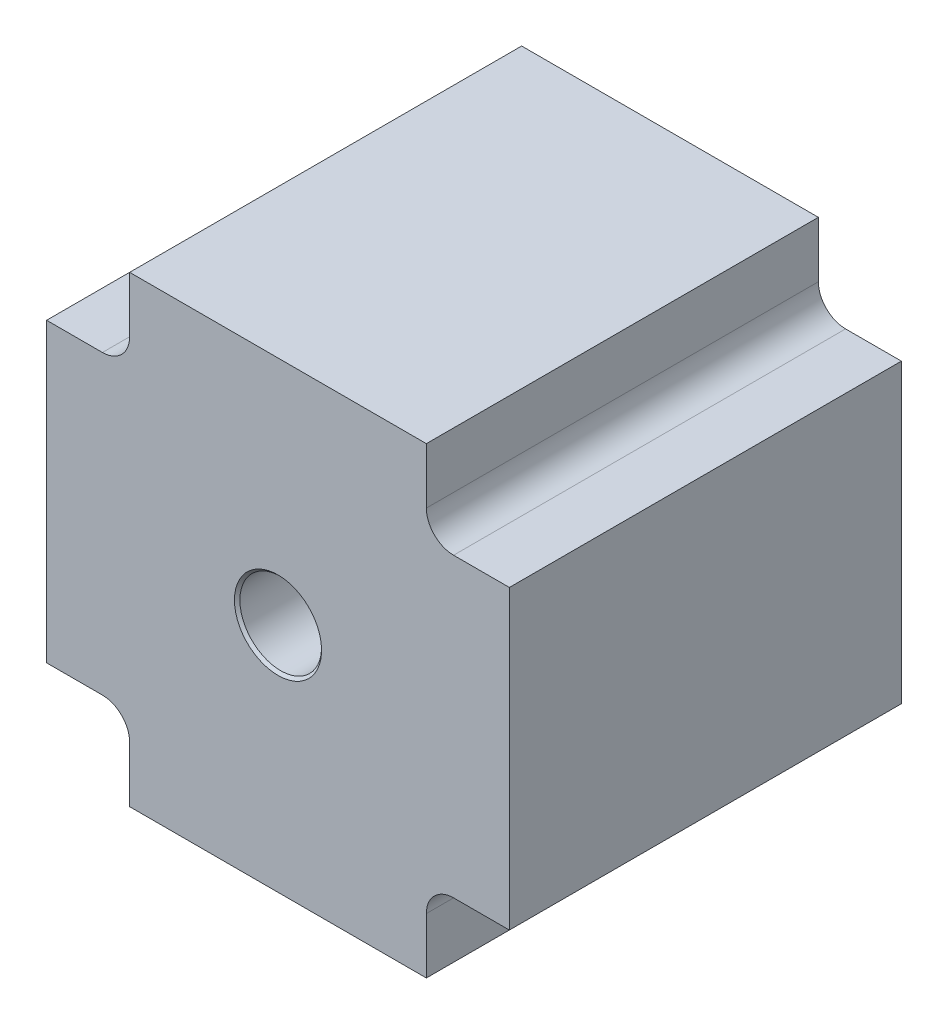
SolidWorks part; units mm, degrees
ref_plane "前视基准面" through (0, 0, 0) normal (0, 0, 1) x (1, 0, 0)
ref_plane "上视基准面" through (0, 0, 0) normal (0, 1, 0) x (1, 0, 0)
ref_plane "右视基准面" through (0, 0, 0) normal (1, 0, 0) x (0, 0, -1)
sketch "草图1" plane through (0, 0, 0) normal (0, 0, 1) x (1, 0, 0)
  line L0 (73.6849, 0) -> (-83.1554, 0) construction
  line L1 (27.25, 42.5) -> (-27.25, 42.5)
  line L2 (27.25, 42.5) -> (27.25, 27.25)
  line L3 (27.25, -42.5) -> (-27.25, -42.5)
  line L4 (-27.25, 42.5) -> (-27.25, 27.25)
  line L5 (27.25, 42.5) -> (-27.25, -42.5) construction
  line L6 (27.25, -42.5) -> (-27.25, 42.5) construction
  line L7 (0, -54.7285) -> (0, 60.804) construction
  line L8 (-27.25, 27.25) -> (-42.5, 27.25)
  line L9 (42.5, -27.25) -> (27.25, -27.25)
  line L10 (42.5, -27.25) -> (42.5, 27.25)
  line L11 (42.5, 27.25) -> (27.25, 27.25)
  line L12 (-42.5, -27.25) -> (-42.5, 27.25)
  line L13 (42.5, -27.25) -> (-42.5, 27.25) construction
  line L14 (42.5, 27.25) -> (-42.5, -27.25) construction
  line L15 (-27.25, -27.25) -> (-27.25, -42.5)
  line L16 (-27.25, -27.25) -> (-42.5, -27.25)
  line L17 (27.25, -27.25) -> (27.25, -42.5)
  point P0 (0, 0)
  point P10 (0, 0)
  dimension "D1" = 54.5
  dimension "D2" = 85
  dimension "D3" = 54.5
  dimension "D4" = 85
extrude "凸台-拉伸1" add sketch "草图1" along normal blind 72
sketch "草图3" plane through (0, 0, 72) normal (0, 0, 1) x (1, 0, 0)
  circle A0 centre (0, 0) radius 7.5
  dimension "D1" = 15
extrude "切除-拉伸2" cut sketch "草图3" against normal through all
chamfer "倒角3" distance 0.5 angle 45 2 edges at (7.5, 0, 0) (7.5, 0, 72)
fillet "圆角1" radius 5 4 edges at (-27.25, -27.25, 36) (27.25, -27.25, 36) (27.25, 27.25, 36) (-27.25, 27.25, 36)
